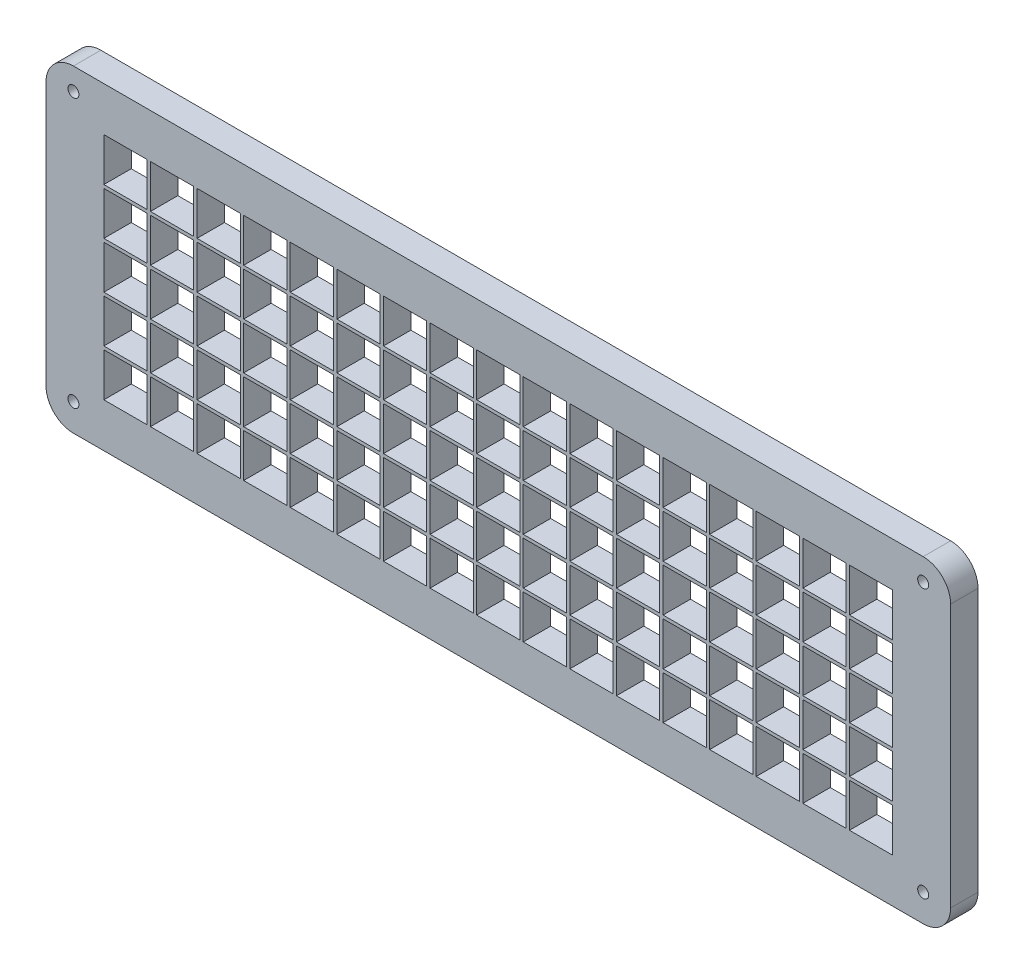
SolidWorks part; units mm, degrees
ref_plane "前视基准面" through (0, 0, 0) normal (0, 0, 1) x (1, 0, 0)
ref_plane "上视基准面" through (0, 0, 0) normal (0, 1, 0) x (1, 0, 0)
ref_plane "右视基准面" through (0, 0, 0) normal (1, 0, 0) x (0, 0, -1)
sketch "草图1" plane through (0, 0, 0) normal (0, 0, 1) x (1, 0, 0)
  line L1 (-165, -58) -> (165, -58)
  line L2 (-165, -58) -> (-165, 58)
  line L3 (-165, 58) -> (165, 58)
  line L4 (165, -58) -> (165, 58)
  line L5 (-165, -58) -> (165, 58) construction
  line L6 (-165, 58) -> (165, -58) construction
  point P0 (0, 0)
extrude "凸台-拉伸1" add sketch "草图1" along normal blind 10
sketch "草图2" plane through (0, 0, 10) normal (0, 0, 1) x (1, 0, 0)
  line L0 (-24.9, 7.9) -> (-9.1, 7.9)
  line L1 (-7.9, -7.9) -> (7.9, -7.9)
  line L2 (-7.9, -7.9) -> (-7.9, 7.9)
  line L3 (-7.9, 7.9) -> (7.9, 7.9)
  line L4 (7.9, -7.9) -> (7.9, 7.9)
  line L5 (-7.9, -7.9) -> (7.9, 7.9) construction
  line L6 (-7.9, 7.9) -> (7.9, -7.9) construction
  line L7 (-24.9, -7.9) -> (-24.9, 7.9)
  line L8 (-24.9, -7.9) -> (-9.1, -7.9)
  line L9 (-9.1, -7.9) -> (-9.1, 7.9)
  line L10 (-41.9, 7.9) -> (-26.1, 7.9)
  line L11 (-41.9, -7.9) -> (-41.9, 7.9)
  line L12 (-41.9, -7.9) -> (-26.1, -7.9)
  line L13 (-26.1, -7.9) -> (-26.1, 7.9)
  line L14 (-58.9, 7.9) -> (-43.1, 7.9)
  line L15 (-58.9, -7.9) -> (-58.9, 7.9)
  line L16 (-58.9, -7.9) -> (-43.1, -7.9)
  line L17 (-43.1, -7.9) -> (-43.1, 7.9)
  line L18 (-75.9, 7.9) -> (-60.1, 7.9)
  line L19 (-75.9, -7.9) -> (-75.9, 7.9)
  line L20 (-75.9, -7.9) -> (-60.1, -7.9)
  line L21 (-60.1, -7.9) -> (-60.1, 7.9)
  line L22 (-92.9, 7.9) -> (-77.1, 7.9)
  line L23 (-92.9, -7.9) -> (-92.9, 7.9)
  line L24 (-92.9, -7.9) -> (-77.1, -7.9)
  line L25 (-77.1, -7.9) -> (-77.1, 7.9)
  line L26 (-109.9, 7.9) -> (-94.1, 7.9)
  line L27 (-109.9, -7.9) -> (-109.9, 7.9)
  line L28 (-109.9, -7.9) -> (-94.1, -7.9)
  line L29 (-94.1, -7.9) -> (-94.1, 7.9)
  line L30 (-126.9, 7.9) -> (-111.1, 7.9)
  line L31 (-126.9, -7.9) -> (-126.9, 7.9)
  line L32 (-126.9, -7.9) -> (-111.1, -7.9)
  line L33 (-111.1, -7.9) -> (-111.1, 7.9)
  line L34 (-143.9, 7.9) -> (-128.1, 7.9)
  line L35 (-143.9, -7.9) -> (-143.9, 7.9)
  line L36 (-143.9, -7.9) -> (-128.1, -7.9)
  line L37 (-128.1, -7.9) -> (-128.1, 7.9)
  line L38 (9.1, 7.9) -> (24.9, 7.9)
  line L39 (9.1, -7.9) -> (9.1, 7.9)
  line L40 (9.1, -7.9) -> (24.9, -7.9)
  line L41 (24.9, -7.9) -> (24.9, 7.9)
  line L42 (26.1, 7.9) -> (41.9, 7.9)
  line L43 (26.1, -7.9) -> (26.1, 7.9)
  line L44 (26.1, -7.9) -> (41.9, -7.9)
  line L45 (41.9, -7.9) -> (41.9, 7.9)
  line L46 (43.1, 7.9) -> (58.9, 7.9)
  line L47 (43.1, -7.9) -> (43.1, 7.9)
  line L48 (43.1, -7.9) -> (58.9, -7.9)
  line L49 (58.9, -7.9) -> (58.9, 7.9)
  line L50 (60.1, 7.9) -> (75.9, 7.9)
  line L51 (60.1, -7.9) -> (60.1, 7.9)
  line L52 (60.1, -7.9) -> (75.9, -7.9)
  line L53 (75.9, -7.9) -> (75.9, 7.9)
  line L54 (77.1, 7.9) -> (92.9, 7.9)
  line L55 (77.1, -7.9) -> (77.1, 7.9)
  line L56 (77.1, -7.9) -> (92.9, -7.9)
  line L57 (92.9, -7.9) -> (92.9, 7.9)
  line L58 (94.1, 7.9) -> (109.9, 7.9)
  line L59 (94.1, -7.9) -> (94.1, 7.9)
  line L60 (94.1, -7.9) -> (109.9, -7.9)
  line L61 (109.9, -7.9) -> (109.9, 7.9)
  line L62 (111.1, 7.9) -> (126.9, 7.9)
  line L63 (111.1, -7.9) -> (111.1, 7.9)
  line L64 (111.1, -7.9) -> (126.9, -7.9)
  line L65 (126.9, -7.9) -> (126.9, 7.9)
  line L66 (128.1, 7.9) -> (143.9, 7.9)
  line L67 (128.1, -7.9) -> (128.1, 7.9)
  line L68 (128.1, -7.9) -> (143.9, -7.9)
  line L69 (143.9, -7.9) -> (143.9, 7.9)
  line L70 (-24.9, 24.9) -> (-9.1, 24.9)
  line L71 (-7.9, 9.1) -> (7.9, 9.1)
  line L72 (-7.9, 9.1) -> (-7.9, 24.9)
  line L73 (-7.9, 24.9) -> (7.9, 24.9)
  line L74 (7.9, 9.1) -> (7.9, 24.9)
  line L75 (-24.9, 9.1) -> (-24.9, 24.9)
  line L76 (-24.9, 9.1) -> (-9.1, 9.1)
  line L77 (-9.1, 9.1) -> (-9.1, 24.9)
  line L78 (-41.9, 24.9) -> (-26.1, 24.9)
  line L79 (-41.9, 9.1) -> (-41.9, 24.9)
  line L80 (-41.9, 9.1) -> (-26.1, 9.1)
  line L81 (-26.1, 9.1) -> (-26.1, 24.9)
  line L82 (-58.9, 24.9) -> (-43.1, 24.9)
  line L83 (-58.9, 9.1) -> (-58.9, 24.9)
  line L84 (-58.9, 9.1) -> (-43.1, 9.1)
  line L85 (-43.1, 9.1) -> (-43.1, 24.9)
  line L86 (-75.9, 24.9) -> (-60.1, 24.9)
  line L87 (-75.9, 9.1) -> (-75.9, 24.9)
  line L88 (-75.9, 9.1) -> (-60.1, 9.1)
  line L89 (-60.1, 9.1) -> (-60.1, 24.9)
  line L90 (-92.9, 24.9) -> (-77.1, 24.9)
  line L91 (-92.9, 9.1) -> (-92.9, 24.9)
  line L92 (-92.9, 9.1) -> (-77.1, 9.1)
  line L93 (-77.1, 9.1) -> (-77.1, 24.9)
  line L94 (-109.9, 24.9) -> (-94.1, 24.9)
  line L95 (-109.9, 9.1) -> (-109.9, 24.9)
  line L96 (-109.9, 9.1) -> (-94.1, 9.1)
  line L97 (-94.1, 9.1) -> (-94.1, 24.9)
  line L98 (-126.9, 24.9) -> (-111.1, 24.9)
  line L99 (-126.9, 9.1) -> (-126.9, 24.9)
  line L100 (-126.9, 9.1) -> (-111.1, 9.1)
  line L101 (-111.1, 9.1) -> (-111.1, 24.9)
  line L102 (-143.9, 24.9) -> (-128.1, 24.9)
  line L103 (-143.9, 9.1) -> (-143.9, 24.9)
  line L104 (-143.9, 9.1) -> (-128.1, 9.1)
  line L105 (-128.1, 9.1) -> (-128.1, 24.9)
  line L106 (9.1, 24.9) -> (24.9, 24.9)
  line L107 (9.1, 9.1) -> (9.1, 24.9)
  line L108 (9.1, 9.1) -> (24.9, 9.1)
  line L109 (24.9, 9.1) -> (24.9, 24.9)
  line L110 (26.1, 24.9) -> (41.9, 24.9)
  line L111 (26.1, 9.1) -> (26.1, 24.9)
  line L112 (26.1, 9.1) -> (41.9, 9.1)
  line L113 (41.9, 9.1) -> (41.9, 24.9)
  line L114 (43.1, 24.9) -> (58.9, 24.9)
  line L115 (43.1, 9.1) -> (43.1, 24.9)
  line L116 (43.1, 9.1) -> (58.9, 9.1)
  line L117 (58.9, 9.1) -> (58.9, 24.9)
  line L118 (60.1, 24.9) -> (75.9, 24.9)
  line L119 (60.1, 9.1) -> (60.1, 24.9)
  line L120 (60.1, 9.1) -> (75.9, 9.1)
  line L121 (75.9, 9.1) -> (75.9, 24.9)
  line L122 (77.1, 24.9) -> (92.9, 24.9)
  line L123 (77.1, 9.1) -> (77.1, 24.9)
  line L124 (77.1, 9.1) -> (92.9, 9.1)
  line L125 (92.9, 9.1) -> (92.9, 24.9)
  line L126 (94.1, 24.9) -> (109.9, 24.9)
  line L127 (94.1, 9.1) -> (94.1, 24.9)
  line L128 (94.1, 9.1) -> (109.9, 9.1)
  line L129 (109.9, 9.1) -> (109.9, 24.9)
  line L130 (111.1, 24.9) -> (126.9, 24.9)
  line L131 (111.1, 9.1) -> (111.1, 24.9)
  line L132 (111.1, 9.1) -> (126.9, 9.1)
  line L133 (126.9, 9.1) -> (126.9, 24.9)
  line L134 (128.1, 24.9) -> (143.9, 24.9)
  line L135 (128.1, 9.1) -> (128.1, 24.9)
  line L136 (128.1, 9.1) -> (143.9, 9.1)
  line L137 (143.9, 9.1) -> (143.9, 24.9)
  line L138 (-7.9, 9.1) -> (7.9, 24.9) construction
  line L139 (-7.9, 24.9) -> (7.9, 9.1) construction
  line L140 (-24.9, 41.9) -> (-9.1, 41.9)
  line L141 (-7.9, 26.1) -> (7.9, 26.1)
  line L142 (-7.9, 26.1) -> (-7.9, 41.9)
  line L143 (-7.9, 41.9) -> (7.9, 41.9)
  line L144 (7.9, 26.1) -> (7.9, 41.9)
  line L145 (-24.9, 26.1) -> (-24.9, 41.9)
  line L146 (-24.9, 26.1) -> (-9.1, 26.1)
  line L147 (-9.1, 26.1) -> (-9.1, 41.9)
  line L148 (-41.9, 41.9) -> (-26.1, 41.9)
  line L149 (-41.9, 26.1) -> (-41.9, 41.9)
  line L150 (-41.9, 26.1) -> (-26.1, 26.1)
  line L151 (-26.1, 26.1) -> (-26.1, 41.9)
  line L152 (-58.9, 41.9) -> (-43.1, 41.9)
  line L153 (-58.9, 26.1) -> (-58.9, 41.9)
  line L154 (-58.9, 26.1) -> (-43.1, 26.1)
  line L155 (-43.1, 26.1) -> (-43.1, 41.9)
  line L156 (-75.9, 41.9) -> (-60.1, 41.9)
  line L157 (-75.9, 26.1) -> (-75.9, 41.9)
  line L158 (-75.9, 26.1) -> (-60.1, 26.1)
  line L159 (-60.1, 26.1) -> (-60.1, 41.9)
  line L160 (-92.9, 41.9) -> (-77.1, 41.9)
  line L161 (-92.9, 26.1) -> (-92.9, 41.9)
  line L162 (-92.9, 26.1) -> (-77.1, 26.1)
  line L163 (-77.1, 26.1) -> (-77.1, 41.9)
  line L164 (-109.9, 41.9) -> (-94.1, 41.9)
  line L165 (-109.9, 26.1) -> (-109.9, 41.9)
  line L166 (-109.9, 26.1) -> (-94.1, 26.1)
  line L167 (-94.1, 26.1) -> (-94.1, 41.9)
  line L168 (-126.9, 41.9) -> (-111.1, 41.9)
  line L169 (-126.9, 26.1) -> (-126.9, 41.9)
  line L170 (-126.9, 26.1) -> (-111.1, 26.1)
  line L171 (-111.1, 26.1) -> (-111.1, 41.9)
  line L172 (-143.9, 41.9) -> (-128.1, 41.9)
  line L173 (-143.9, 26.1) -> (-143.9, 41.9)
  line L174 (-143.9, 26.1) -> (-128.1, 26.1)
  line L175 (-128.1, 26.1) -> (-128.1, 41.9)
  line L176 (9.1, 41.9) -> (24.9, 41.9)
  line L177 (9.1, 26.1) -> (9.1, 41.9)
  line L178 (9.1, 26.1) -> (24.9, 26.1)
  line L179 (24.9, 26.1) -> (24.9, 41.9)
  line L180 (26.1, 41.9) -> (41.9, 41.9)
  line L181 (26.1, 26.1) -> (26.1, 41.9)
  line L182 (26.1, 26.1) -> (41.9, 26.1)
  line L183 (41.9, 26.1) -> (41.9, 41.9)
  line L184 (43.1, 41.9) -> (58.9, 41.9)
  line L185 (43.1, 26.1) -> (43.1, 41.9)
  line L186 (43.1, 26.1) -> (58.9, 26.1)
  line L187 (58.9, 26.1) -> (58.9, 41.9)
  line L188 (60.1, 41.9) -> (75.9, 41.9)
  line L189 (60.1, 26.1) -> (60.1, 41.9)
  line L190 (60.1, 26.1) -> (75.9, 26.1)
  line L191 (75.9, 26.1) -> (75.9, 41.9)
  line L192 (77.1, 41.9) -> (92.9, 41.9)
  line L193 (77.1, 26.1) -> (77.1, 41.9)
  line L194 (77.1, 26.1) -> (92.9, 26.1)
  line L195 (92.9, 26.1) -> (92.9, 41.9)
  line L196 (94.1, 41.9) -> (109.9, 41.9)
  line L197 (94.1, 26.1) -> (94.1, 41.9)
  line L198 (94.1, 26.1) -> (109.9, 26.1)
  line L199 (109.9, 26.1) -> (109.9, 41.9)
  line L200 (111.1, 41.9) -> (126.9, 41.9)
  line L201 (111.1, 26.1) -> (111.1, 41.9)
  line L202 (111.1, 26.1) -> (126.9, 26.1)
  line L203 (126.9, 26.1) -> (126.9, 41.9)
  line L204 (128.1, 41.9) -> (143.9, 41.9)
  line L205 (128.1, 26.1) -> (128.1, 41.9)
  line L206 (128.1, 26.1) -> (143.9, 26.1)
  line L207 (143.9, 26.1) -> (143.9, 41.9)
  line L208 (-7.9, 26.1) -> (7.9, 41.9) construction
  line L209 (-7.9, 41.9) -> (7.9, 26.1) construction
  line L210 (-24.9, -9.1) -> (-9.1, -9.1)
  line L211 (-7.9, -24.9) -> (7.9, -24.9)
  line L212 (-7.9, -24.9) -> (-7.9, -9.1)
  line L213 (-7.9, -9.1) -> (7.9, -9.1)
  line L214 (7.9, -24.9) -> (7.9, -9.1)
  line L215 (-24.9, -24.9) -> (-24.9, -9.1)
  line L216 (-24.9, -24.9) -> (-9.1, -24.9)
  line L217 (-9.1, -24.9) -> (-9.1, -9.1)
  line L218 (-41.9, -9.1) -> (-26.1, -9.1)
  line L219 (-41.9, -24.9) -> (-41.9, -9.1)
  line L220 (-41.9, -24.9) -> (-26.1, -24.9)
  line L221 (-26.1, -24.9) -> (-26.1, -9.1)
  line L222 (-58.9, -9.1) -> (-43.1, -9.1)
  line L223 (-58.9, -24.9) -> (-58.9, -9.1)
  line L224 (-58.9, -24.9) -> (-43.1, -24.9)
  line L225 (-43.1, -24.9) -> (-43.1, -9.1)
  line L226 (-75.9, -9.1) -> (-60.1, -9.1)
  line L227 (-75.9, -24.9) -> (-75.9, -9.1)
  line L228 (-75.9, -24.9) -> (-60.1, -24.9)
  line L229 (-60.1, -24.9) -> (-60.1, -9.1)
  line L230 (-92.9, -9.1) -> (-77.1, -9.1)
  line L231 (-92.9, -24.9) -> (-92.9, -9.1)
  line L232 (-92.9, -24.9) -> (-77.1, -24.9)
  line L233 (-77.1, -24.9) -> (-77.1, -9.1)
  line L234 (-109.9, -9.1) -> (-94.1, -9.1)
  line L235 (-109.9, -24.9) -> (-109.9, -9.1)
  line L236 (-109.9, -24.9) -> (-94.1, -24.9)
  line L237 (-94.1, -24.9) -> (-94.1, -9.1)
  line L238 (-126.9, -9.1) -> (-111.1, -9.1)
  line L239 (-126.9, -24.9) -> (-126.9, -9.1)
  line L240 (-126.9, -24.9) -> (-111.1, -24.9)
  line L241 (-111.1, -24.9) -> (-111.1, -9.1)
  line L242 (-143.9, -9.1) -> (-128.1, -9.1)
  line L243 (-143.9, -24.9) -> (-143.9, -9.1)
  line L244 (-143.9, -24.9) -> (-128.1, -24.9)
  line L245 (-128.1, -24.9) -> (-128.1, -9.1)
  line L246 (9.1, -9.1) -> (24.9, -9.1)
  line L247 (9.1, -24.9) -> (9.1, -9.1)
  line L248 (9.1, -24.9) -> (24.9, -24.9)
  line L249 (24.9, -24.9) -> (24.9, -9.1)
  line L250 (26.1, -9.1) -> (41.9, -9.1)
  line L251 (26.1, -24.9) -> (26.1, -9.1)
  line L252 (26.1, -24.9) -> (41.9, -24.9)
  line L253 (41.9, -24.9) -> (41.9, -9.1)
  line L254 (43.1, -9.1) -> (58.9, -9.1)
  line L255 (43.1, -24.9) -> (43.1, -9.1)
  line L256 (43.1, -24.9) -> (58.9, -24.9)
  line L257 (58.9, -24.9) -> (58.9, -9.1)
  line L258 (60.1, -9.1) -> (75.9, -9.1)
  line L259 (60.1, -24.9) -> (60.1, -9.1)
  line L260 (60.1, -24.9) -> (75.9, -24.9)
  line L261 (75.9, -24.9) -> (75.9, -9.1)
  line L262 (77.1, -9.1) -> (92.9, -9.1)
  line L263 (77.1, -24.9) -> (77.1, -9.1)
  line L264 (77.1, -24.9) -> (92.9, -24.9)
  line L265 (92.9, -24.9) -> (92.9, -9.1)
  line L266 (94.1, -9.1) -> (109.9, -9.1)
  line L267 (94.1, -24.9) -> (94.1, -9.1)
  line L268 (94.1, -24.9) -> (109.9, -24.9)
  line L269 (109.9, -24.9) -> (109.9, -9.1)
  line L270 (111.1, -9.1) -> (126.9, -9.1)
  line L271 (111.1, -24.9) -> (111.1, -9.1)
  line L272 (111.1, -24.9) -> (126.9, -24.9)
  line L273 (126.9, -24.9) -> (126.9, -9.1)
  line L274 (128.1, -9.1) -> (143.9, -9.1)
  line L275 (128.1, -24.9) -> (128.1, -9.1)
  line L276 (128.1, -24.9) -> (143.9, -24.9)
  line L277 (143.9, -24.9) -> (143.9, -9.1)
  line L278 (-7.9, -24.9) -> (7.9, -9.1) construction
  line L279 (-7.9, -9.1) -> (7.9, -24.9) construction
  line L280 (-24.9, -26.1) -> (-9.1, -26.1)
  line L281 (-7.9, -41.9) -> (7.9, -41.9)
  line L282 (-7.9, -41.9) -> (-7.9, -26.1)
  line L283 (-7.9, -26.1) -> (7.9, -26.1)
  line L284 (7.9, -41.9) -> (7.9, -26.1)
  line L285 (-24.9, -41.9) -> (-24.9, -26.1)
  line L286 (-24.9, -41.9) -> (-9.1, -41.9)
  line L287 (-9.1, -41.9) -> (-9.1, -26.1)
  line L288 (-41.9, -26.1) -> (-26.1, -26.1)
  line L289 (-41.9, -41.9) -> (-41.9, -26.1)
  line L290 (-41.9, -41.9) -> (-26.1, -41.9)
  line L291 (-26.1, -41.9) -> (-26.1, -26.1)
  line L292 (-58.9, -26.1) -> (-43.1, -26.1)
  line L293 (-58.9, -41.9) -> (-58.9, -26.1)
  line L294 (-58.9, -41.9) -> (-43.1, -41.9)
  line L295 (-43.1, -41.9) -> (-43.1, -26.1)
  line L296 (-75.9, -26.1) -> (-60.1, -26.1)
  line L297 (-75.9, -41.9) -> (-75.9, -26.1)
  line L298 (-75.9, -41.9) -> (-60.1, -41.9)
  line L299 (-60.1, -41.9) -> (-60.1, -26.1)
  line L300 (-92.9, -26.1) -> (-77.1, -26.1)
  line L301 (-92.9, -41.9) -> (-92.9, -26.1)
  line L302 (-92.9, -41.9) -> (-77.1, -41.9)
  line L303 (-77.1, -41.9) -> (-77.1, -26.1)
  line L304 (-109.9, -26.1) -> (-94.1, -26.1)
  line L305 (-109.9, -41.9) -> (-109.9, -26.1)
  line L306 (-109.9, -41.9) -> (-94.1, -41.9)
  line L307 (-94.1, -41.9) -> (-94.1, -26.1)
  line L308 (-126.9, -26.1) -> (-111.1, -26.1)
  line L309 (-126.9, -41.9) -> (-126.9, -26.1)
  line L310 (-126.9, -41.9) -> (-111.1, -41.9)
  line L311 (-111.1, -41.9) -> (-111.1, -26.1)
  line L312 (-143.9, -26.1) -> (-128.1, -26.1)
  line L313 (-143.9, -41.9) -> (-143.9, -26.1)
  line L314 (-143.9, -41.9) -> (-128.1, -41.9)
  line L315 (-128.1, -41.9) -> (-128.1, -26.1)
  line L316 (9.1, -26.1) -> (24.9, -26.1)
  line L317 (9.1, -41.9) -> (9.1, -26.1)
  line L318 (9.1, -41.9) -> (24.9, -41.9)
  line L319 (24.9, -41.9) -> (24.9, -26.1)
  line L320 (26.1, -26.1) -> (41.9, -26.1)
  line L321 (26.1, -41.9) -> (26.1, -26.1)
  line L322 (26.1, -41.9) -> (41.9, -41.9)
  line L323 (41.9, -41.9) -> (41.9, -26.1)
  line L324 (43.1, -26.1) -> (58.9, -26.1)
  line L325 (43.1, -41.9) -> (43.1, -26.1)
  line L326 (43.1, -41.9) -> (58.9, -41.9)
  line L327 (58.9, -41.9) -> (58.9, -26.1)
  line L328 (60.1, -26.1) -> (75.9, -26.1)
  line L329 (60.1, -41.9) -> (60.1, -26.1)
  line L330 (60.1, -41.9) -> (75.9, -41.9)
  line L331 (75.9, -41.9) -> (75.9, -26.1)
  line L332 (77.1, -26.1) -> (92.9, -26.1)
  line L333 (77.1, -41.9) -> (77.1, -26.1)
  line L334 (77.1, -41.9) -> (92.9, -41.9)
  line L335 (92.9, -41.9) -> (92.9, -26.1)
  line L336 (94.1, -26.1) -> (109.9, -26.1)
  line L337 (94.1, -41.9) -> (94.1, -26.1)
  line L338 (94.1, -41.9) -> (109.9, -41.9)
  line L339 (109.9, -41.9) -> (109.9, -26.1)
  line L340 (111.1, -26.1) -> (126.9, -26.1)
  line L341 (111.1, -41.9) -> (111.1, -26.1)
  line L342 (111.1, -41.9) -> (126.9, -41.9)
  line L343 (126.9, -41.9) -> (126.9, -26.1)
  line L344 (128.1, -26.1) -> (143.9, -26.1)
  line L345 (128.1, -41.9) -> (128.1, -26.1)
  line L346 (128.1, -41.9) -> (143.9, -41.9)
  line L347 (143.9, -41.9) -> (143.9, -26.1)
  line L348 (-7.9, -41.9) -> (7.9, -26.1) construction
  line L349 (-7.9, -26.1) -> (7.9, -41.9) construction
  point P0 (0, 0)
  point P71 (0, -17)
  point P72 (0, 17)
  point P141 (0, 34)
  point P278 (0, -34)
  dimension "D1" = 9
  dimension "D2" = 9
  dimension "D4" = 3
  dimension "D3" = 3
extrude "切除-拉伸3" cut sketch "草图2" against normal through all
fillet "圆角2" radius 10 4 edges at (165, 58, 5) (165, -58, 5) (-165, -58, 5) (-165, 58, 5)
sketch "草图3" plane through (0, 0, 10) normal (0, 0, 1) x (1, 0, 0)
  line L0 (-143.9, 41.9) -> (-143.9, 58)
  line L1 (155, 58) -> (-155, 58) construction
  line L2 (-143.9, 49.95) -> (-155, 49.95)
  line L3 (143.9, 41.9) -> (143.9, 58)
  line L4 (143.9, 58) -> (143.9, 49.95)
  line L5 (143.9, 49.95) -> (155, 49.95)
  line L6 (155, 49.95) -> (155, -48)
  line L7 (155, -48) -> (-155, -48)
  line L8 (-155, -48) -> (-155, 49.95)
  line L9 (143.9, 49.95) -> (-155, 49.95)
  circle A0 centre (-155, 49.95) radius 2.001
  circle A1 centre (155, 49.95) radius 2
  circle A2 centre (155, -48) radius 2
  circle A3 centre (-155, -48) radius 2
extrude "切除-拉伸4" cut sketch "草图3" against normal through all contours L8 A3 L7 | L7 A3 L8 | L9 A0 L8 | L8 A0 L9 | L7 A2 L6 | L6 A2 L7 | L6 A1 L5 | L5 A1 L6
